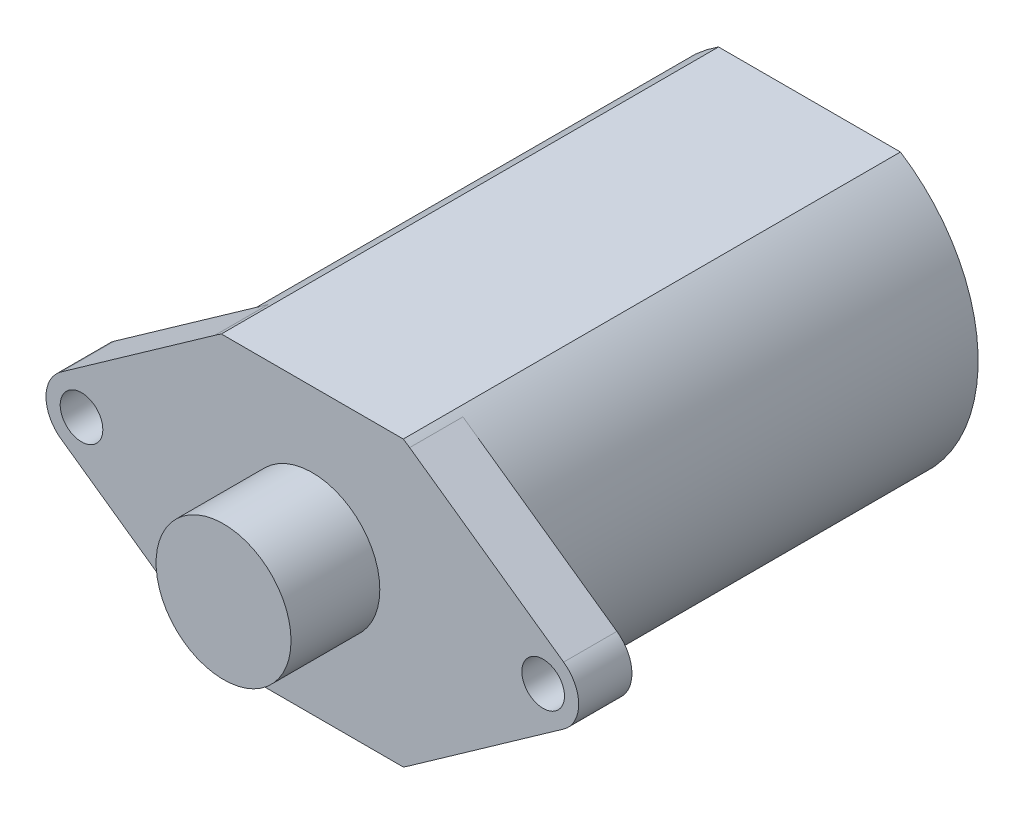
SolidWorks part; units mm, degrees
ref_plane "前视基准面" through (0, 0, 0) normal (0, 0, 1) x (1, 0, 0)
ref_plane "上视基准面" through (0, 0, 0) normal (0, 1, 0) x (1, 0, 0)
ref_plane "右视基准面" through (0, 0, 0) normal (1, 0, 0) x (0, 0, -1)
sketch "草图1" plane through (0, 0, 0) normal (0, 0, 1) x (1, 0, 0)
  circle A0 centre (0, 0) radius 47.5
  dimension "D1" = 95
extrude "拉伸1" add sketch "草图1" along normal blind 140
sketch "草图2" plane through (0, 0, 140) normal (0, 0, 1) x (1, 0, 0)
  line L0 (-72.3708, 0) -> (82.4045, 0) construction
  line L1 (-70.7692, 8.168) -> (-27.4038, 38.7979)
  line L2 (-70.7692, -8.168) -> (-27.4038, -38.7979)
  line L3 (70.7692, 8.168) -> (27.4038, 38.7979)
  line L4 (27.4038, -38.7979) -> (70.7692, -8.168)
  arc A0 (-70.7692, 8.168) -> (-70.7692, -8.168) centre (-65, 0) ccw
  arc A1 (70.7692, -8.168) -> (70.7692, 8.168) centre (65, 0) ccw
  circle A2 centre (0, 0) radius 47.5 construction
  arc A3 (27.4038, -38.7979) -> (27.4038, 38.7979) centre (0, 0) ccw
  arc A4 (-27.4038, 38.7979) -> (-27.4038, -38.7979) centre (0, 0) ccw
  dimension "D1" = 130
  dimension "D2" = 65
  dimension "D3" = 20
  dimension "D4" = 20
extrude "拉伸2" add sketch "草图2" against normal blind 15
sketch "草图3" plane through (0, 0, 0) normal (0, 0, -1) x (-1, 0, 0)
  line L0 (-25.6174, 40) -> (25.6174, 40)
  line L1 (-25.6174, -40) -> (25.6174, -40)
  arc A0 (25.6174, 40) -> (-25.6174, 40) centre (0, 0) ccw
  circle A1 centre (0, 0) radius 47.5
  arc A2 (-25.6174, -40) -> (25.6174, -40) centre (0, 0) ccw
  dimension "D2" = 40
  dimension "D3" = 40
  dimension "D1" = 0
extrude "切除-拉伸1" cut sketch "草图3" against normal up to surface (140 mm away)
sketch "草图4" plane through (0, 0, 140) normal (0, 0, 1) x (1, 0, 0)
  circle A0 centre (-65, 0) radius 6
  circle A1 centre (65, 0) radius 6
  dimension "D1" = 12
  dimension "D2" = 12
extrude "切除-拉伸2" cut sketch "草图4" against normal through all
sketch "草图5" plane through (0, 0, 140) normal (0, 0, 1) x (1, 0, 0)
  circle A0 centre (0, 0) radius 19
  dimension "D1" = 38
extrude "拉伸3" add sketch "草图5" along normal blind 25
